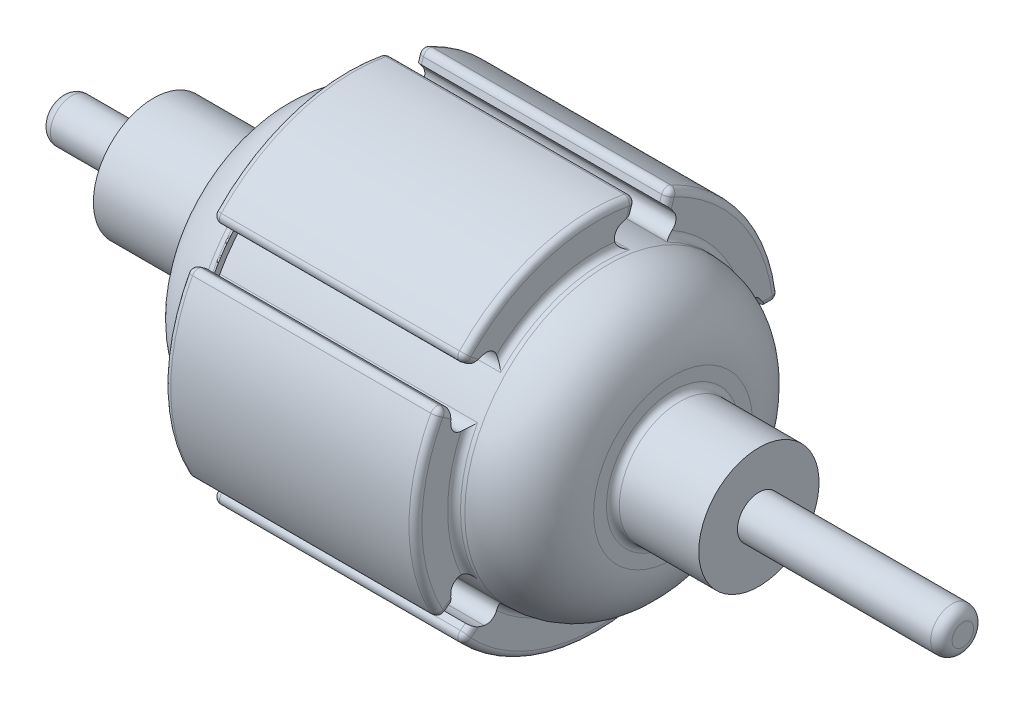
SolidWorks part; units mm, degrees
ref_plane "Plan1" through (0, 0, 0) normal (0, 0, 1) x (1, 0, 0)
ref_plane "Plan2" through (0, 0, 0) normal (0, 1, 0) x (1, 0, 0)
ref_plane "Plan3" through (0, 0, 0) normal (1, 0, 0) x (0, 0, -1)
sketch "Esquisse1" plane through (0, 0, 0) normal (0, 0, 1) x (1, 0, 0)
  line L0 (0, 0) -> (0, 0.5)
  line L1 (0.5, 1) -> (4.3, 1)
  line L2 (4.3, 1) -> (4.3, 2.8)
  line L3 (4.3, 2.8) -> (9.5, 2.8)
  line L4 (9.8, 3.1) -> (9.8, 3.7)
  line L5 (12.8, 6.7) -> (13, 6.7)
  line L6 (13.3, 7) -> (13.3, 8.2)
  line L7 (13.6, 8.5) -> (24.7, 8.5)
  line L8 (25, 8.2) -> (25, 7)
  line L9 (25.3, 6.7) -> (25.5, 6.7)
  line L10 (28.5, 3.7) -> (28.5, 3.1)
  line L11 (28.8, 2.8) -> (32.5, 2.8)
  line L12 (32.5, 2.8) -> (32.5, 1)
  line L13 (32.5, 1) -> (41.5, 1)
  line L14 (42, 0.5) -> (42, 0)
  line L15 (42, 0) -> (0, 0)
  line L16 (0, 0) -> (61, 0) construction
  arc A0 (0.5, 1) -> (0, 0.5) centre (0.5, 0.5) ccw
  arc A1 (41.5, 1) -> (42, 0.5) centre (41.5, 0.5) cw
  arc A2 (28.5, 3.7) -> (25.5, 6.7) centre (25.5, 3.7) ccw
  arc A3 (28.8, 2.8) -> (28.5, 3.1) centre (28.8, 3.1) cw
  arc A4 (25.3, 6.7) -> (25, 7) centre (25.3, 7) cw
  arc A5 (24.7, 8.5) -> (25, 8.2) centre (24.7, 8.2) cw
  arc A6 (13.3, 8.2) -> (13.6, 8.5) centre (13.6, 8.2) cw
  arc A7 (13, 6.7) -> (13.3, 7) centre (13, 7) ccw
  arc A8 (9.5, 2.8) -> (9.8, 3.1) centre (9.5, 3.1) ccw
  arc A9 (12.8, 6.7) -> (9.8, 3.7) centre (12.8, 3.7) ccw
  point P19 (0, 1)
  point P22 (42, 1)
  point P25 (28.5, 6.7)
  point P28 (28.5, 2.8)
  point P31 (25, 6.7)
  point P34 (25, 8.5)
  point P37 (13.3, 8.5)
  point P40 (13.3, 6.7)
  point P43 (9.8, 2.8)
  point P46 (9.8, 6.7)
  dimension "D12" = 0.5
  dimension "D13" = 3
  dimension "D14" = 0.3
  dimension "D15" = 3
  dimension "D1" = 4.3
  dimension "D2" = 5.5
  dimension "D3" = 3.5
  dimension "D4" = 3.5
  dimension "D5" = 4
  dimension "D6" = 9.5
  dimension "D7" = 11.7
  dimension "D8" = 1
  dimension "D9" = 2.8
  dimension "D10" = 6.7
  dimension "D11" = 8.5
  dimension "D16" = 42
revolve "Base-Révolution" add sketch "Esquisse1" angle 360 about L16
sketch "Esquisse2" plane through (13.3, 0, 0) normal (-1, 0, 0) x (0, 0, 1)
  line L0 (0, 0) -> (-12.3693, 0) construction
  line L1 (-1.6597, 7.6969) -> (-2.3393, 9.7884)
  line L2 (-7.833, 0.8) -> (-10.0322, 0.8)
  line L3 (-10.0322, 0.8) -> (-10.0322, -0.8)
  line L4 (-2.3393, 9.7884) -> (-3.861, 9.294)
  line L5 (-7.833, -0.8) -> (-10.0322, -0.8)
  line L6 (-3.1814, 7.2024) -> (-3.861, 9.294)
  line L7 (6.8073, 3.9569) -> (8.5865, 5.2496)
  line L8 (8.5865, 5.2496) -> (7.646, 6.544)
  line L9 (5.8668, 5.2514) -> (7.646, 6.544)
  line L10 (5.8668, -5.2514) -> (7.646, -6.544)
  line L11 (7.646, -6.544) -> (8.5865, -5.2496)
  line L12 (6.8073, -3.9569) -> (8.5865, -5.2496)
  line L13 (-3.1814, -7.2024) -> (-3.861, -9.294)
  line L14 (-3.861, -9.294) -> (-2.3393, -9.7884)
  line L15 (-1.6597, -7.6969) -> (-2.3393, -9.7884)
  arc A0 (-6.6372, 0.9153) -> (-6.6372, -0.9153) centre (0, 0) ccw
  circle A1 centre (0, 0) radius 6.7 construction
  arc A2 (-7.51, 1.3114) -> (-7.833, 0.8) centre (-6, 0) ccw
  arc A3 (-6.6372, 0.9153) -> (-7.51, 1.3114) centre (-7.1325, 0.9836) ccw
  arc A4 (-6.6372, -0.9153) -> (-7.51, -1.3114) centre (-7.1325, -0.9836) cw
  arc A5 (-7.51, -1.3114) -> (-7.833, -0.8) centre (-6, 0) cw
  arc A6 (-1.1805, 6.5952) -> (-2.9215, 6.0295) centre (0, 0) ccw
  arc A7 (-1.0735, 7.5477) -> (-1.6597, 7.6969) centre (-1.8541, 5.7063) ccw
  arc A8 (-1.1805, 6.5952) -> (-1.0735, 7.5477) centre (-1.2686, 7.0874) ccw
  arc A9 (-2.9215, 6.0295) -> (-3.568, 6.7372) centre (-3.1395, 6.4795) cw
  arc A10 (-3.568, 6.7372) -> (-3.1814, 7.2024) centre (-1.8541, 5.7063) cw
  arc A11 (5.9076, 3.1608) -> (4.8316, 4.6417) centre (0, 0) ccw
  arc A12 (6.8466, 3.3533) -> (6.8073, 3.9569) centre (4.8541, 3.5267) ccw
  arc A13 (5.9076, 3.1608) -> (6.8466, 3.3533) centre (6.3485, 3.3966) ccw
  arc A14 (4.8316, 4.6417) -> (5.3049, 5.4753) centre (5.1922, 4.9881) cw
  arc A15 (5.3049, 5.4753) -> (5.8668, 5.2514) centre (4.8541, 3.5267) cw
  arc A16 (4.8316, -4.6417) -> (5.9076, -3.1608) centre (0, 0) ccw
  arc A17 (5.3049, -5.4753) -> (5.8668, -5.2514) centre (4.8541, -3.5267) ccw
  arc A18 (4.8316, -4.6417) -> (5.3049, -5.4753) centre (5.1922, -4.9881) ccw
  arc A19 (5.9076, -3.1608) -> (6.8466, -3.3533) centre (6.3485, -3.3966) cw
  arc A20 (6.8466, -3.3533) -> (6.8073, -3.9569) centre (4.8541, -3.5267) cw
  arc A21 (-2.9215, -6.0295) -> (-1.1805, -6.5952) centre (0, 0) ccw
  arc A22 (-3.568, -6.7372) -> (-3.1814, -7.2024) centre (-1.8541, -5.7063) ccw
  arc A23 (-2.9215, -6.0295) -> (-3.568, -6.7372) centre (-3.1395, -6.4795) ccw
  arc A24 (-1.1805, -6.5952) -> (-1.0735, -7.5477) centre (-1.2686, -7.0874) cw
  arc A25 (-1.0735, -7.5477) -> (-1.6597, -7.6969) centre (-1.8541, -5.7063) cw
  point P7 (-0.0024, 0)
  point P10 (-2.5765, -7.9223)
  dimension "D1" = 4
  dimension "D3" = 1
  dimension "D2" = 6
  dimension "D4" = 1.6
extrude "Enlèv. mat.-Extru.1" cut sketch "Esquisse2" against normal through all
fillet "Congé1" radius 0.3 50 edges at (24.8866, 7.7387, -3.3556) (25, 7.3583, -3.232) (13.3888, 7.7178, -3.3488) (19.15, 7.8009, -3.3758) (25, 7.8528, -1.7104) (24.9112, 8.2123, -1.8272) (19.15, 8.2953, -1.8541) (13.4134, 8.2331, -1.8339) (13.3, 7.8528, -1.7104) (13.3, 7.3583, -3.232) (24.8866, 5.5828, 6.323) (25, 5.3477, 5.9994) (13.3888, 5.5699, 6.3052) (19.15, 5.6212, 6.3759) (25, 4.0533, 6.9399) (24.9112, 4.2755, 7.2457) (19.15, 4.3268, 7.3163) (13.4134, 4.2883, 7.2634) (13.3, 4.0533, 6.9399) (13.3, 5.3477, 5.9994) (24.8866, -4.2883, 7.2634) (25, -4.0533, 6.9399) (13.3888, -4.2755, 7.2457) (19.15, -4.3268, 7.3163) (25, -5.3477, 5.9994) (24.9112, -5.5699, 6.3052) (19.15, -5.6212, 6.3759) (13.4134, -5.5828, 6.323) (13.3, -5.3477, 5.9994) (13.3, -4.0533, 6.9399) (24.8866, -8.2331, -1.8339) (25, -7.8528, -1.7104) (13.3888, -8.2123, -1.8272) (19.15, -8.2953, -1.8541) (25, -7.3583, -3.232) (24.9112, -7.7178, -3.3488) (19.15, -7.8009, -3.3758) (13.4134, -7.7387, -3.3556) (13.3, -7.3583, -3.232) (13.3, -7.8528, -1.7104) (24.4737, -0.8, -7.963) (25, -0.8, -7.997) (13.8216, -0.8, -7.9577) (19.15, -0.8, -8.4623) (25, 0.8, -7.997) (24.4997, 0.8, -7.9365) (19.15, 0.8, -8.4623) (13.7744, 0.8, -7.9156) (13.3, 0.8, -7.997) (13.3, -0.8, -7.997)
